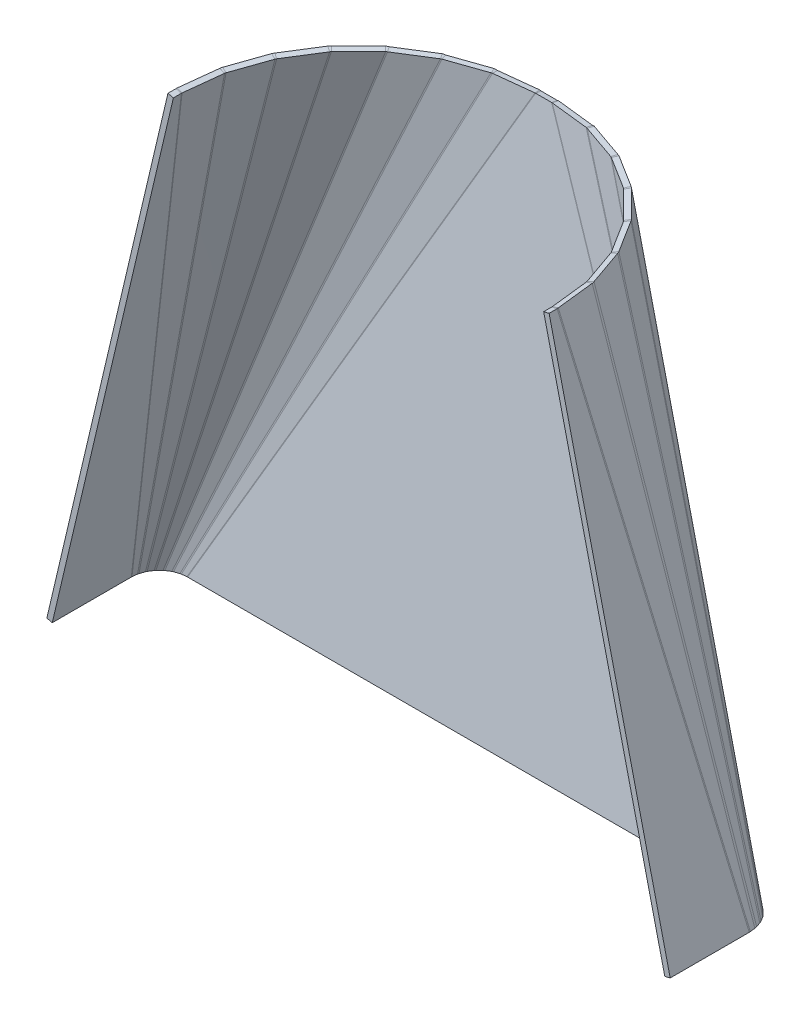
SolidWorks part; units mm, degrees
ref_plane "Ebene vorne" through (0, 0, 0) normal (0, 0, 1) x (1, 0, 0)
ref_plane "Ebene oben" through (0, 0, 0) normal (0, 1, 0) x (1, 0, 0)
ref_plane "Ebene rechts" through (0, 0, 0) normal (1, 0, 0) x (0, 0, -1)
sketch "Skizze1" plane through (0, 0, 0) normal (0, 1, 0) x (1, 0, 0)
  line L1 (-110, 0) -> (-110, 28.3922)
  line L2 (-99.8922, 38.5) -> (99.8922, 38.5)
  line L3 (0, 0) -> (-110, 0) construction
  line L4 (-109.9884, 28.6072) -> (-109.7928, 30.4162)
  line L5 (-109.697, 30.8478) -> (-109.1088, 32.5696)
  line L6 (-108.9138, 32.9806) -> (-107.9517, 34.525)
  line L7 (-107.6684, 34.8817) -> (-106.3817, 36.1684)
  line L8 (-106.025, 36.4517) -> (-104.4806, 37.4138)
  line L9 (-104.0696, 37.6088) -> (-102.3478, 38.197)
  line L10 (-101.9162, 38.2928) -> (-100.1072, 38.4884)
  line L11 (-100, 38.5) -> (-100, 28.5) construction
  line L12 (100, 38.5) -> (100, 28.5) construction
  line L13 (101.9162, 38.2928) -> (100.1072, 38.4884)
  line L14 (104.0696, 37.6088) -> (102.3478, 38.197)
  line L15 (106.025, 36.4517) -> (104.4806, 37.4138)
  line L16 (107.6684, 34.8817) -> (106.3817, 36.1684)
  line L17 (0, 0) -> (0, 38.5) construction
  line L18 (108.9138, 32.9806) -> (107.9517, 34.525)
  line L19 (109.697, 30.8478) -> (109.1088, 32.5696)
  line L20 (109.9884, 28.6072) -> (109.7928, 30.4162)
  line L21 (110, 0) -> (110, 28.3922)
  arc A0 (-102.3478, 38.197) -> (-101.9162, 38.2928) centre (-101.7012, 36.3044) cw
  arc A1 (-100, 38.5) -> (-110, 28.5) centre (-100, 28.5) ccw construction
  arc A2 (-104.4806, 37.4138) -> (-104.0696, 37.6088) centre (-103.4231, 35.7162) cw
  arc A3 (-106.3817, 36.1684) -> (-106.025, 36.4517) centre (-104.9675, 34.7541) cw
  arc A4 (-107.9517, 34.525) -> (-107.6684, 34.8817) centre (-106.2541, 33.4675) cw
  arc A5 (-109.1088, 32.5696) -> (-108.9138, 32.9806) centre (-107.2162, 31.9231) cw
  arc A6 (-109.7928, 30.4162) -> (-109.697, 30.8478) centre (-107.8044, 30.2012) cw
  arc A7 (-110, 28.3922) -> (-109.9884, 28.6072) centre (-108, 28.3922) cw
  arc A8 (-99.8922, 38.5) -> (-100.1072, 38.4884) centre (-99.8922, 36.5) ccw
  arc A9 (100, 38.5) -> (110, 28.5) centre (100, 28.5) cw construction
  arc A10 (99.8922, 38.5) -> (100.1072, 38.4884) centre (99.8922, 36.5) cw
  arc A11 (110, 28.3922) -> (109.9884, 28.6072) centre (108, 28.3922) ccw
  arc A12 (109.7928, 30.4162) -> (109.697, 30.8478) centre (107.8044, 30.2012) ccw
  arc A13 (109.1088, 32.5696) -> (108.9138, 32.9806) centre (107.2162, 31.9231) ccw
  arc A14 (107.9517, 34.525) -> (107.6684, 34.8817) centre (106.2541, 33.4675) ccw
  arc A15 (106.3817, 36.1684) -> (106.025, 36.4517) centre (104.9675, 34.7541) ccw
  arc A16 (104.4806, 37.4138) -> (104.0696, 37.6088) centre (103.4231, 35.7162) ccw
  arc A17 (102.3478, 38.197) -> (101.9162, 38.2928) centre (101.7012, 36.3044) ccw
  point P14 (-102.1373, 38.2689)
  point P18 (-104.2863, 37.5348)
  point P21 (-106.2196, 36.3305)
  point P24 (-107.8305, 34.7196)
  point P27 (-109.0348, 32.7863)
  point P30 (-109.7689, 30.6373)
  point P65 (109.7689, 30.6373)
  point P66 (109.0348, 32.7863)
  point P67 (107.8305, 34.7196)
  point P68 (106.2196, 36.3305)
  point P69 (104.2863, 37.5348)
  point P70 (102.1373, 38.2689)
  dimension "D3" = 10
  dimension "D4" = 2
  dimension "D1" = 38.5
  dimension "D2" = 110
ref_plane "Ebene1" through (0, 185, 0) normal (0, 1, 0) x (-1, 0, 0)
sketch "Skizze2" plane through (0, 185, 0) normal (0, 1, 0) x (-1, 0, 0)
  line L0 (-66.5, 0) -> (66.5, 0) construction
  line L2 (0, 0) -> (0, -66.5) construction
  line L3 (-66.5, 0) -> (-66.5, -2.8883)
  line L4 (-2.8883, -66.5) -> (2.8883, -66.5)
  line L5 (16.8261, -64.9513) -> (3.111, -66.4876)
  line L6 (-66.4876, -3.111) -> (-64.9513, -16.8261)
  line L7 (-64.8522, -17.262) -> (-60.3076, -30.2932)
  line L8 (-60.1132, -30.6978) -> (-52.7768, -42.3872)
  line L9 (-52.497, -42.7383) -> (-42.7383, -52.497)
  line L10 (-42.3872, -52.7768) -> (-30.6978, -60.1132)
  line L11 (-30.2932, -60.3076) -> (-17.262, -64.8522)
  line L12 (-16.8261, -64.9513) -> (-3.111, -66.4876)
  line L13 (30.2932, -60.3076) -> (17.262, -64.8522)
  line L14 (42.3872, -52.7768) -> (30.6978, -60.1132)
  line L15 (52.497, -42.7383) -> (42.7383, -52.497)
  line L16 (60.1132, -30.6978) -> (52.7768, -42.3872)
  line L17 (64.8522, -17.262) -> (60.3076, -30.2932)
  line L18 (66.4876, -3.111) -> (64.9513, -16.8261)
  line L19 (66.5, 0) -> (66.5, -2.8883)
  arc A0 (-66.5, -3) -> (-3, -66.5) centre (-3, -3) ccw construction
  arc A1 (3.111, -66.4876) -> (2.8883, -66.5) centre (2.8883, -64.5) cw
  arc A2 (-66.5, -2.8883) -> (-66.4876, -3.111) centre (-64.5, -2.8883) ccw
  arc A3 (-64.9513, -16.8261) -> (-64.8522, -17.262) centre (-62.9637, -16.6035) ccw
  arc A4 (-60.3076, -30.2932) -> (-60.1132, -30.6978) centre (-58.4191, -29.6346) ccw
  arc A5 (-52.7768, -42.3872) -> (-52.497, -42.7383) centre (-51.0828, -41.3241) ccw
  arc A6 (-42.7383, -52.497) -> (-42.3872, -52.7768) centre (-41.3241, -51.0828) ccw
  arc A7 (-30.6978, -60.1132) -> (-30.2932, -60.3076) centre (-29.6346, -58.4191) ccw
  arc A8 (-17.262, -64.8522) -> (-16.8261, -64.9513) centre (-16.6035, -62.9637) ccw
  arc A9 (-3.111, -66.4876) -> (-2.8883, -66.5) centre (-2.8883, -64.5) ccw
  arc A10 (17.262, -64.8522) -> (16.8261, -64.9513) centre (16.6035, -62.9637) cw
  arc A11 (30.6978, -60.1132) -> (30.2932, -60.3076) centre (29.6346, -58.4191) cw
  arc A12 (42.7383, -52.497) -> (42.3872, -52.7768) centre (41.3241, -51.0828) cw
  arc A13 (52.7768, -42.3872) -> (52.497, -42.7383) centre (51.0828, -41.3241) cw
  arc A14 (60.3076, -30.2932) -> (60.1132, -30.6978) centre (58.4191, -29.6346) cw
  arc A15 (64.9513, -16.8261) -> (64.8522, -17.262) centre (62.9637, -16.6035) cw
  arc A16 (66.5, -2.8883) -> (66.4876, -3.111) centre (64.5, -2.8883) cw
  point P24 (-64.9262, -17.0496)
  point P27 (-60.2332, -30.5065)
  point P30 (-52.6567, -42.5786)
  point P33 (-42.5786, -52.6567)
  point P36 (-30.5065, -60.2332)
  point P39 (-17.0496, -64.9262)
  point P64 (17.0496, -64.9262)
  point P65 (30.5065, -60.2332)
  point P66 (42.5786, -52.6567)
  point P67 (52.6567, -42.5786)
  point P68 (60.2332, -30.5065)
  point P69 (64.9262, -17.0496)
  dimension "D4" = 2
  dimension "D1" = 133
  dimension "D2" = 3
  dimension "D3" = 66.5
sheet metal parameters "Blech1" thickness 2 parameters "D1"=1, "Dicke"=2
lofted bend "Ausgeformte Biegungen1" parameters "D1"=0, "D12"=2
other "Freiform-Biegung19" parameters "D1"=1000, "D4"=57.296, "D5"=1
other "Freiform-Biegung21" parameters "D1"=1000, "D4"=57.296, "D5"=2
other "Freiform-Biegung22" parameters "D1"=1000, "D4"=57.296, "D5"=3
other "Freiform-Biegung23" parameters "D1"=1000, "D4"=57.296, "D5"=4
other "Freiform-Biegung24" parameters "D1"=1000, "D4"=57.296, "D5"=5
other "Freiform-Biegung25" parameters "D1"=1000, "D4"=57.296, "D5"=6
other "Freiform-Biegung26" parameters "D1"=1000, "D4"=57.296, "D5"=7
other "Freiform-Biegung27" parameters "D1"=1000, "D4"=57.296, "D5"=8
other "Freiform-Biegung28" parameters "D1"=1000, "D4"=57.296, "D5"=9
other "Freiform-Biegung29" parameters "D1"=1000, "D4"=57.296, "D5"=10
other "Freiform-Biegung30" parameters "D1"=1000, "D4"=57.296, "D5"=11
other "Freiform-Biegung31" parameters "D1"=1000, "D4"=57.296, "D5"=12
other "Freiform-Biegung32" parameters "D1"=1000, "D4"=57.296, "D5"=13
other "Freiform-Biegung33" parameters "D1"=1000, "D4"=57.296, "D5"=14
other "Freiform-Biegung34" parameters "D1"=1000, "D4"=57.296, "D5"=15
other "Freiform-Biegung35" parameters "D1"=1000, "D4"=57.296, "D5"=16
other "Freiform-Biegung36" parameters "D1"=1000, "D4"=57.296, "D5"=17
other "Freiform-Biegung37" parameters "D1"=1000, "D4"=57.296, "D5"=18
other "Freiform-Biegung38" parameters "D1"=1000, "D4"=57.296, "D5"=19
other "Freiform-Biegung39" parameters "D1"=1000, "D4"=57.296, "D5"=20
other "Freiform-Biegung40" parameters "D1"=1000, "D4"=57.296, "D5"=21
other "Freiform-Biegung41" parameters "D1"=1000, "D4"=57.296, "D5"=22
other "Freiform-Biegung42" parameters "D1"=1000, "D4"=57.296, "D5"=23
other "Freiform-Biegung43" parameters "D1"=1000, "D4"=57.296, "D5"=24
other "Freiform-Biegung44" parameters "D1"=1000, "D4"=57.296, "D5"=25
other "Freiform-Biegung45" parameters "D1"=1000, "D4"=57.296, "D5"=26
other "Freiform-Biegung46" parameters "D1"=1000, "D4"=57.296, "D5"=27
other "Freiform-Biegung47" parameters "D1"=1000, "D4"=57.296, "D5"=28
other "Freiform-Biegung48" parameters "D1"=1000, "D4"=57.296, "D5"=29
other "Freiform-Biegung49" parameters "D1"=1000, "D4"=57.296, "D5"=30
other "Freiform-Biegung50" parameters "D1"=1000, "D4"=57.296, "D5"=31
other "Freiform-Biegung51" parameters "D1"=1000, "D4"=57.296, "D5"=32
flat pattern "Abwicklung1"
sketch "Biegung-Linien1" plane through (0, -5.6965, -37.6378) normal (0, 0.1496, 0.9887) x (1, 0, 0)
other "Abwickeln-<Freiform-Biegung19>1"
other "Abwickeln-<Freiform-Biegung21>1"
other "Abwickeln-<Freiform-Biegung22>1"
other "Abwickeln-<Freiform-Biegung23>1"
other "Abwickeln-<Freiform-Biegung24>1"
other "Abwickeln-<Freiform-Biegung25>1"
other "Abwickeln-<Freiform-Biegung26>1"
other "Abwickeln-<Freiform-Biegung27>1"
other "Abwickeln-<Freiform-Biegung28>1"
other "Abwickeln-<Freiform-Biegung29>1"
other "Abwickeln-<Freiform-Biegung30>1"
other "Abwickeln-<Freiform-Biegung31>1"
other "Abwickeln-<Freiform-Biegung32>1"
other "Abwickeln-<Freiform-Biegung33>1"
other "Abwickeln-<Freiform-Biegung34>1"
other "Abwickeln-<Freiform-Biegung35>1"
other "Abwickeln-<Freiform-Biegung36>1"
other "Abwickeln-<Freiform-Biegung37>1"
other "Abwickeln-<Freiform-Biegung38>1"
other "Abwickeln-<Freiform-Biegung39>1"
other "Abwickeln-<Freiform-Biegung40>1"
other "Abwickeln-<Freiform-Biegung41>1"
other "Abwickeln-<Freiform-Biegung42>1"
other "Abwickeln-<Freiform-Biegung43>1"
other "Abwickeln-<Freiform-Biegung44>1"
other "Abwickeln-<Freiform-Biegung45>1"
other "Abwickeln-<Freiform-Biegung46>1"
other "Abwickeln-<Freiform-Biegung47>1"
other "Abwickeln-<Freiform-Biegung48>1"
other "Abwickeln-<Freiform-Biegung49>1"
other "Abwickeln-<Freiform-Biegung50>1"
other "Abwickeln-<Freiform-Biegung51>1"
